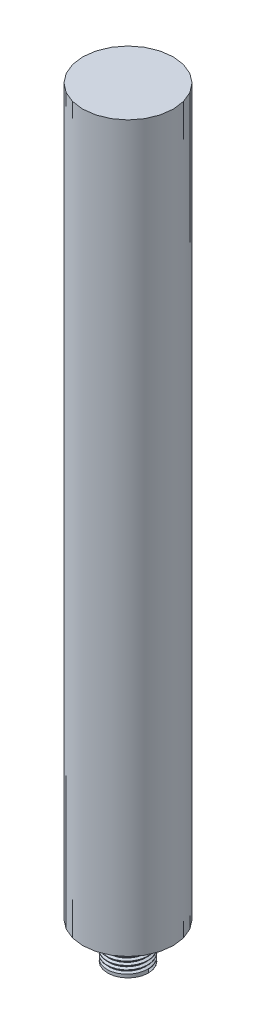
SolidWorks part; units mm, degrees
ref_plane "Front Plane" through (0, 0, 0) normal (0, 0, 1) x (1, 0, 0)
ref_plane "Top Plane" through (0, 0, 0) normal (0, 1, 0) x (1, 0, 0)
ref_plane "Right Plane" through (0, 0, 0) normal (1, 0, 0) x (0, 0, -1)
sketch "Sketch1" plane through (0, 0, 0) normal (0, 1, 0) x (1, 0, 0)
  circle A0 centre (0, 0) radius 12.7
  dimension "D1" = 25.4
extrude "Boss-Extrude1" add sketch "Sketch1" along normal blind 203.2
sketch "Sketch2" plane through (0, 0, 0) normal (0, -1, 0) x (1, 0, 0)
  circle A0 centre (0, 0) radius 5.715
  dimension "D1" = 11.43
extrude "Boss-Extrude2" add sketch "Sketch2" along normal blind 10.16
thread "Thread1" pitch 1.0583 start angle 0, offset 0, length 10.16, pitch 1.0583, diameter 11.43
ref_plane "Plane1" through (5.715, -10.16, 0) normal (0, 0, 1) x (1, 0, 0)
sketch "Thread Profile1" plane through (5.715, -10.16, 0) normal (0, 0, 1) x (1, 0, 0)
  line L0 (0, 0) -> (0, 1.0583) construction
  line L11 (0, 0) -> (0, 0.926)
  line L12 (0, 0.926) -> (-0.5728, 0.5953)
  line L13 (-0.5728, 0.5953) -> (-0.5728, 0.3307)
  line L15 (-0.5728, 0.3307) -> (0, 0)
  line L17 (-0.5728, 0.463) -> (0, 0.463) construction
  point P2 (0, 0)
  dimension "Pitch" = 1.0583
  dimension "Profile_Angle" = 60
  dimension "Profile_Land" = 0.2646
  dimension "Profile_Height" = 0.5728
